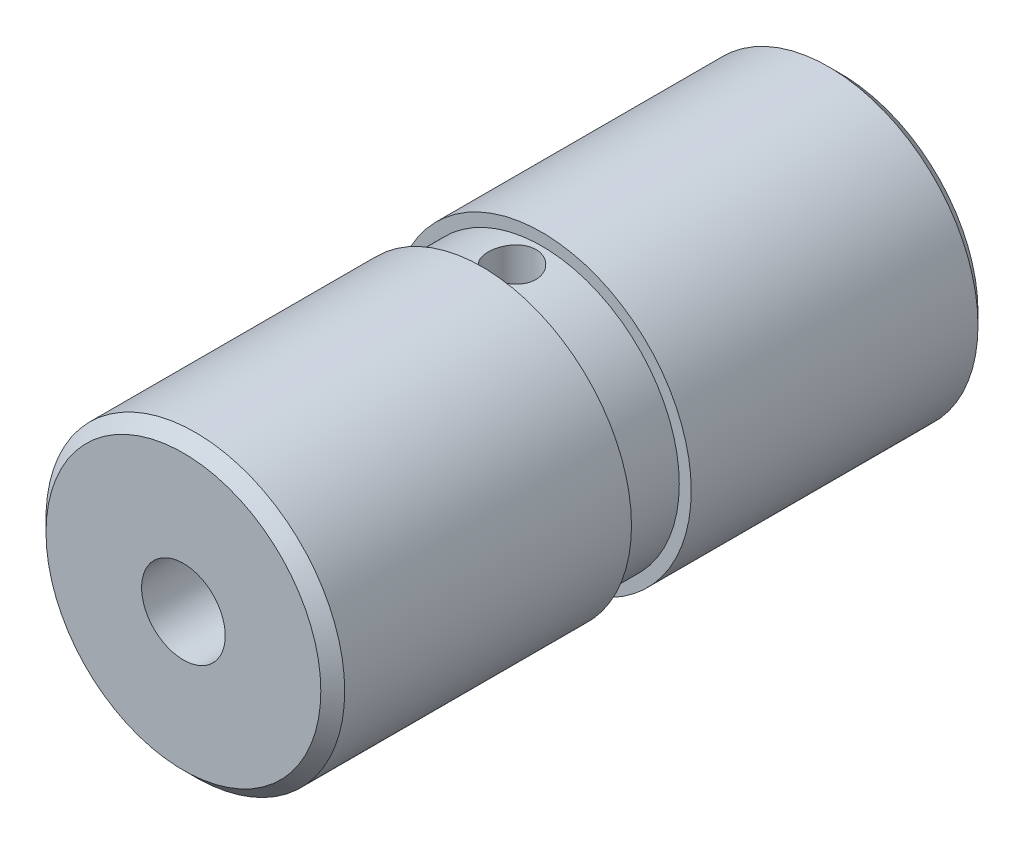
SolidWorks part; units mm, degrees
ref_plane "Piano frontale" through (0, 0, 0) normal (0, 0, 1) x (1, 0, 0)
ref_plane "Piano superiore" through (0, 0, 0) normal (0, 1, 0) x (1, 0, 0)
ref_plane "Piano destro" through (0, 0, 0) normal (1, 0, 0) x (0, 0, -1)
sketch "Schizzo1" plane through (0, 0, 0) normal (0, 0, 1) x (1, 0, 0)
  circle A0 centre (0, 0) radius 12.5
  dimension "D1" = 25
extrude "Estrusione1" add sketch "Schizzo1" along normal blind 55
chamfer "Smusso1" distance 1 angle 45 2 edges at (12.5, 0, 0) (12.5, 0, 55)
hole_wizard "Ø4.0 (4) Foro diametrale1" positions "Schizzo3" profile "Schizzo2" hole size "Ø4.0" standard "ISO"
sketch "Schizzo3" plane through (0, 0, 0) normal (0, 0, -1) x (-1, 0, 0)
  point P0 (0, 0)
sketch "Schizzo2" plane through (0, 0, 0) normal (1, 0, 0) x (0, 1, 0)
  line L0 (0, 0) -> (0, 55)
  line L1 (0, 55) -> (2, 55)
  line L2 (2, 55) -> (2, 0)
  line L5 (2, 0) -> (0, 0)
  line L11 (0, -6.35) -> (0, 107.95) construction
  dimension "Thru Hole Dia." = 4
  dimension "Thru Hole Depth" = 55
hole_wizard "M8x1.0 Foro filettato profondo1" positions "Schizzo5" profile "Schizzo4" tap size "M8x1.0" standard "ISO"
sketch "Schizzo5" plane through (0, 0, 0) normal (0, 0, -1) x (-1, 0, 0)
  point P0 (0, 0)
sketch "Schizzo4" plane through (0, 0, 0) normal (1, 0, 0) x (0, 1, 0)
  line L0 (0, 0) -> (0, 23.103)
  line L1 (0, 23.103) -> (3.5, 21)
  line L2 (3.5, 21) -> (3.5, 0)
  line L5 (3.5, 0) -> (0, 0)
  line L10 (0, 23.103) -> (-3.5, 21) construction
  line L11 (0, -6.35) -> (0, 107.95) construction
  dimension "Tap Drill Dia." = 7
  dimension "Tap Drill Depth" = 21
  dimension "Drill Angle" = 118
hole_wizard "M8x1.0 Foro filettato profondo2" positions "Schizzo7" profile "Schizzo6" tap size "M8x1.0" standard "ISO"
sketch "Schizzo7" plane through (0, 0, 55) normal (0, 0, 1) x (1, 0, 0)
  point P0 (0, 0)
sketch "Schizzo6" plane through (0, 0, 55) normal (1, 0, 0) x (0, -1, 0)
  line L0 (0, 0) -> (0, 23.103)
  line L1 (0, 23.103) -> (3.5, 21)
  line L2 (3.5, 21) -> (3.5, 0)
  line L5 (3.5, 0) -> (0, 0)
  line L10 (0, 23.103) -> (-3.5, 21) construction
  line L11 (0, -6.35) -> (0, 107.95) construction
  dimension "Tap Drill Dia." = 7
  dimension "Tap Drill Depth" = 21
  dimension "Drill Angle" = 118
hole_wizard "Ø4.0 (4) Foro diametrale2" positions "Schizzo9" profile "Schizzo8" hole size "Ø4.0" standard "ISO"
sketch "Schizzo9" plane through (0, 0, 0) normal (0, 1, 0) x (1, 0, 0)
  line L0 (0, -54) -> (0, -1) construction
  point P0 (0, -27.5)
  dimension "D1" = 27.5
sketch "Schizzo8" plane through (0, 0, 27.5) normal (1, 0, 0) x (0, 0, -1)
  line L0 (0, 0) -> (0, 12.5)
  line L1 (0, 12.5) -> (2, 12.5)
  line L2 (2, 12.5) -> (2, 0)
  line L5 (2, 0) -> (0, 0)
  line L11 (0, -6.35) -> (0, 107.95) construction
  dimension "Thru Hole Dia." = 4
  dimension "Thru Hole Depth" = 12.5
sketch "Schizzo10" plane through (0, 0, 0) normal (1, 0, 0) x (0, 0, -1)
  line L0 (-54, -12.5) -> (-1, -12.5) construction
  line L1 (-30, -12.5) -> (-25, -12.5)
  line L2 (-30, -12.5) -> (-30, -11.5)
  line L3 (-30, -11.5) -> (-25, -11.5)
  line L4 (-25, -12.5) -> (-25, -11.5)
  line L5 (-55, 11.5) -> (-55, -11.5) construction
  dimension "D1" = 1
  dimension "D2" = 25
  dimension "D3" = 5
revolve "Taglia-Rivoluzione1" cut sketch "Schizzo10" angle 360 about axis through (0, 0, 55) along (0, 0, -1)
